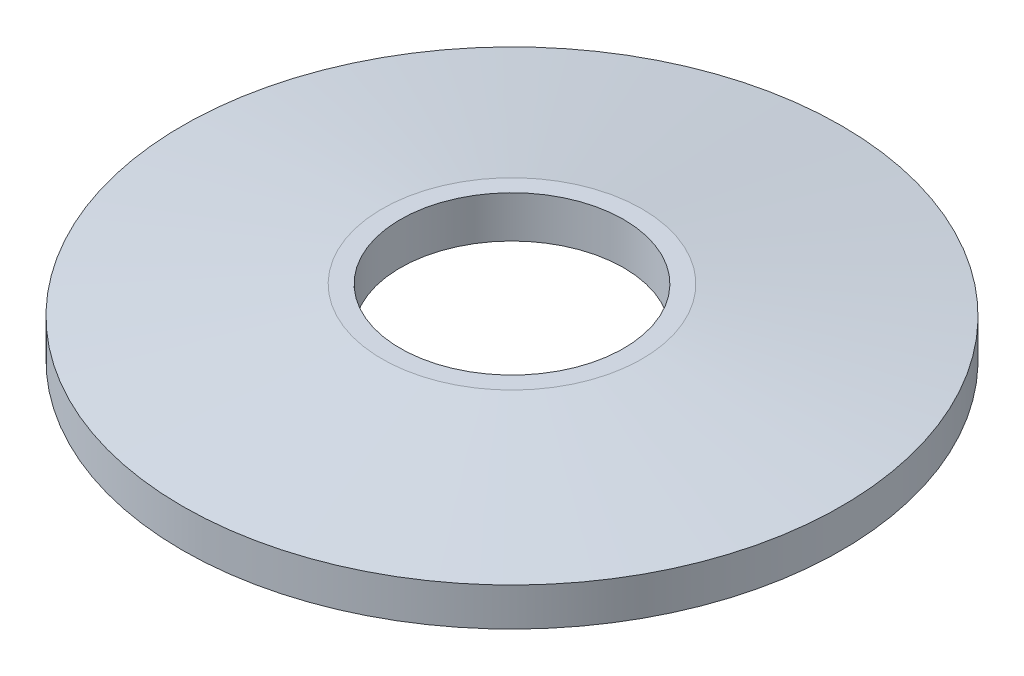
SolidWorks part; units mm, degrees
ref_plane "X" through (0, 0, 0) normal (0, 0, 1) x (1, 0, 0)
ref_plane "Y" through (0, 0, 0) normal (0, 1, 0) x (1, 0, 0)
ref_plane "Z" through (0, 0, 0) normal (1, 0, 0) x (0, 0, -1)
sketch "Esquisse1" plane through (0, 0, 0) normal (0, 0, 1) x (1, 0, 0)
  line L0 (0, 0) -> (0, 4.4057) construction
  line L1 (3.05, 0) -> (3.05, -1.1419)
  line L2 (3.5508, 0) -> (9, -0.7579)
  line L3 (9, -0.7579) -> (9, -1.8)
  line L4 (7.7819, -1.8) -> (3.05, -1.1419)
  line L6 (3.05, 0) -> (3.5508, 0)
  line L7 (7.7819, -1.8) -> (9, -1.8)
  dimension "D1" = 6.1
  dimension "D2" = 18
  dimension "D3" = 1.2
  dimension "D4" = 1.8
  dimension "D5" = 0.6581
  dimension "D6" = 15.5638
revolve "Base-Révolution" add sketch "Esquisse1" angle 360 about L0
